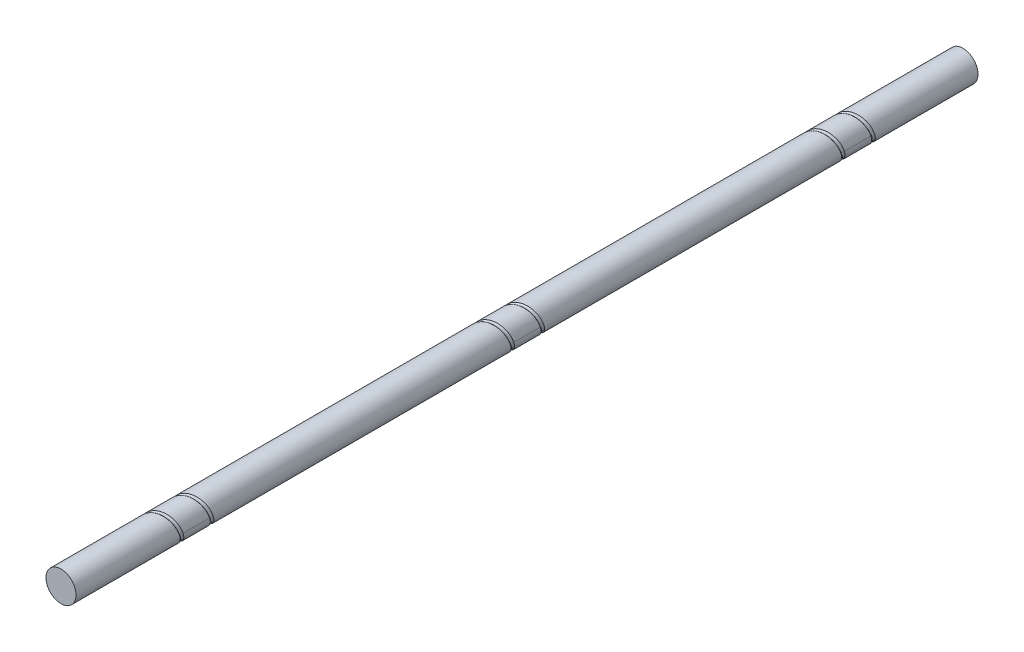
SolidWorks part; units mm, degrees
ref_plane "Front Plane" through (0, 0, 0) normal (0, 0, 1) x (1, 0, 0)
ref_plane "Top Plane" through (0, 0, 0) normal (0, 1, 0) x (1, 0, 0)
ref_plane "Right Plane" through (0, 0, 0) normal (1, 0, 0) x (0, 0, -1)
sketch "Sketch1" plane through (0, 0, 0) normal (0, 0, 1) x (1, 0, 0)
  circle A0 centre (0, 0) radius 25
  dimension "D1" = 50
extrude "Boss-Extrude1" add sketch "Sketch1" along normal blind 1500
ref_plane "Plane1" through (0, 0, 150) normal (0, 0, 1) x (1, 0, 0)
sketch "Sketch2" plane through (0, 0, 150) normal (0, 0, 1) x (1, 0, 0)
  circle A0 centre (0, 0) radius 27.646
  dimension "D1" = 55.292
curve "Helix/Spiral1"
sketch "Sketch3" plane through (0, 0, 0) normal (0, 1, 0) x (1, 0, 0)
  circle A0 centre (-27.646, -150) radius 3.969
  spline S0 degree 3 poles (-27.646, -150) (-27.646, -150.7073) (-26.9833, -152.1286) (-24.0718, -154.2551) (-19.4496, -156.383) (-13.4454, -158.5106) (-6.4857, -160.6383) (0.9349, -162.766) (8.289, -164.8936) (15.0541, -167.0213) (20.7495, -169.1489) (24.9703, -171.2766) (27.4167, -173.4043) (27.9149, -175.5319) (26.4293, -177.6596) (23.0657, -179.7872) (18.063, -181.9149) (11.7766, -184.0426) (4.6535, -186.1702) (-2.8004, -188.2979) (-10.0553, -190.4255) (-16.5956, -192.5532) (-21.9566, -194.6809) (-25.7573, -196.8085) (-27.7277, -198.9362) (-27.7277, -201.0638) (-25.7573, -203.1915) (-21.9566, -205.3191) (-16.5956, -207.4468) (-10.0553, -209.5745) (-2.8004, -211.7021) (4.6535, -213.8298) (11.7766, -215.9574) (18.063, -218.0851) (23.0657, -220.2128) (26.4293, -222.3404) (27.9149, -224.4681) (27.4167, -226.5957) (24.9703, -228.7234) (20.7495, -230.8511) (15.0541, -232.9787) (8.289, -235.1064) (0.9349, -237.234) (-6.4857, -239.3617) (-13.4454, -241.4894) (-19.4496, -243.617) (-24.0718, -245.7449) (-26.9833, -247.8714) (-27.646, -249.2927) (-27.646, -250) knots 0 0 0 0 0.021277 0.042553 0.06383 0.085106 0.106383 0.12766 0.148936 0.170213 0.191489 0.212766 0.234043 0.255319 0.276596 0.297872 0.319149 0.340426 0.361702 0.382979 0.404255 0.425532 0.446809 0.468085 0.489362 0.510638 0.531915 0.553191 0.574468 0.595745 0.617021 0.638298 0.659574 0.680851 0.702128 0.723404 0.744681 0.765957 0.787234 0.808511 0.829787 0.851064 0.87234 0.893617 0.914894 0.93617 0.957447 0.978723 1 1 1 1 construction
  dimension "D1" = 7.938
sweep "Cut-Sweep1" cut profiles "Sketch3" path "Helix/Spiral1"
pattern_linear "LPattern1" count 3 spacing 550 along (0, 0, -1) of "Cut-Sweep1"
